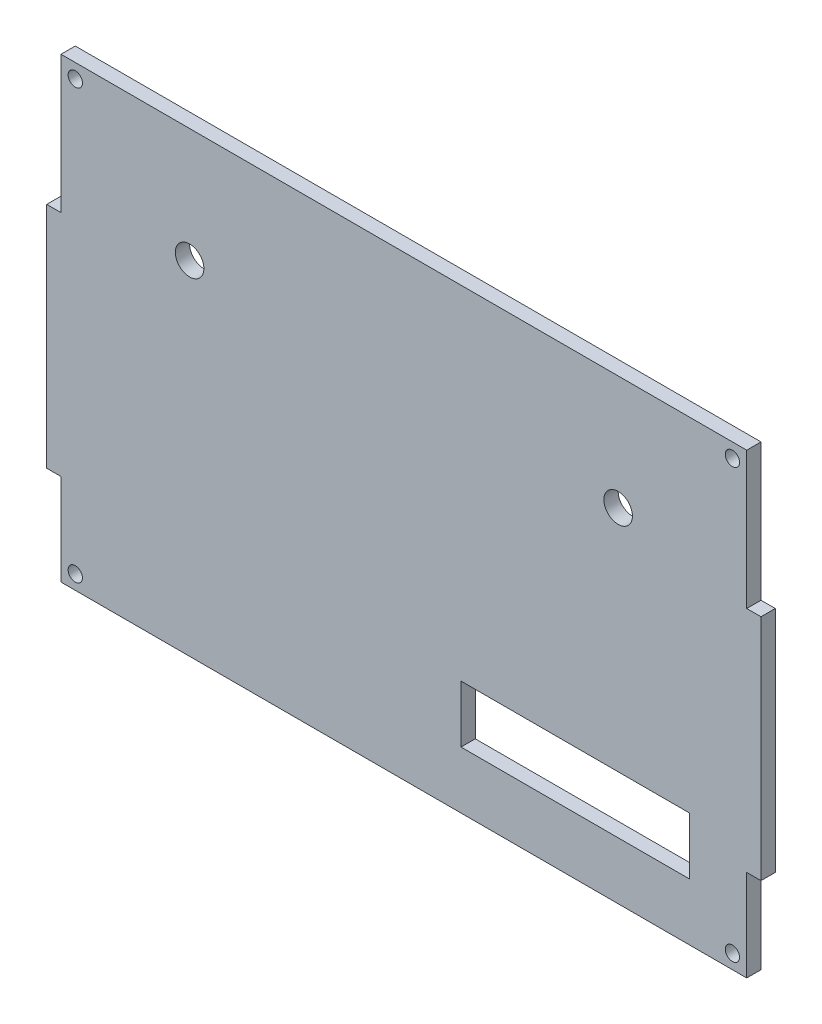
SolidWorks part; units mm, degrees
ref_plane "Front Plane" through (0, 0, 0) normal (0, 0, 1) x (1, 0, 0)
ref_plane "Top Plane" through (0, 0, 0) normal (0, 1, 0) x (1, 0, 0)
ref_plane "Right Plane" through (0, 0, 0) normal (1, 0, 0) x (0, 0, -1)
sketch "Sketch1" plane through (0, 0, 0) normal (0, 0, 1) x (1, 0, 0)
  line L0 (-28.1521, -62.2363) -> (-28.1521, -82.5563)
  line L1 (-28.1521, 19.0437) -> (124.2479, 19.0437)
  line L2 (-28.1521, 19.0437) -> (-28.1521, -11.4363)
  line L3 (-28.1521, -82.5563) -> (124.2479, -82.5563)
  line L4 (124.2479, 19.0437) -> (124.2479, -11.4363)
  line L5 (-28.1521, -11.4363) -> (-31.3271, -11.4363)
  line L6 (124.2479, -62.2363) -> (124.2479, -82.5563)
  line L7 (-28.1521, -62.2363) -> (-31.3271, -62.2363)
  line L8 (-31.3271, -11.4363) -> (-31.3271, -62.2363)
  line L9 (124.2479, -11.4363) -> (127.4229, -11.4363)
  line L11 (124.2479, -62.2363) -> (127.4229, -62.2363)
  line L12 (127.4229, -11.4363) -> (127.4229, -62.2363)
  line L13 (60.7479, -57.1563) -> (111.5479, -57.1563)
  line L14 (60.7479, -57.1563) -> (60.7479, -69.8563)
  line L15 (60.7479, -69.8563) -> (111.5479, -69.8563)
  line L16 (111.5479, -57.1563) -> (111.5479, -69.8563)
  circle A0 centre (-24.9771, -79.3813) radius 1.5875
  circle A1 centre (-24.9771, 15.8687) radius 1.5875
  circle A2 centre (121.0729, 15.8687) radius 1.5875
  circle A3 centre (121.0729, -79.3813) radius 1.5875
  circle A4 centre (0.4229, -6.3563) radius 3.175
  circle A5 centre (95.6729, -6.3563) radius 3.175
  dimension "D13" = 3.175
  dimension "D14" = 3.175
  dimension "D15" = 3.175
  dimension "D16" = 3.175
  dimension "D25" = 6.35
  dimension "D28" = 6.35
  dimension "D1" = 152.4
  dimension "D2" = 101.6
  dimension "D3" = 3.175
  dimension "D4" = 3.175
  dimension "D5" = 50.8
  dimension "D6" = 50.8
  dimension "D7" = 20.32
  dimension "D8" = 20.32
  dimension "D9" = 12.7
  dimension "D10" = 12.7
  dimension "D11" = 50.8
  dimension "D12" = 12.7
  dimension "D17" = 3.175
  dimension "D18" = 3.175
  dimension "D19" = 3.175
  dimension "D20" = 3.175
  dimension "D21" = 3.175
  dimension "D22" = 3.175
  dimension "D23" = 3.175
  dimension "D24" = 3.175
  dimension "D26" = 76.2
  dimension "D27" = 28.575
  dimension "D29" = 28.575
  dimension "D30" = 76.2
extrude "Boss-Extrude2" add sketch "Sketch1" along normal blind 3.175
